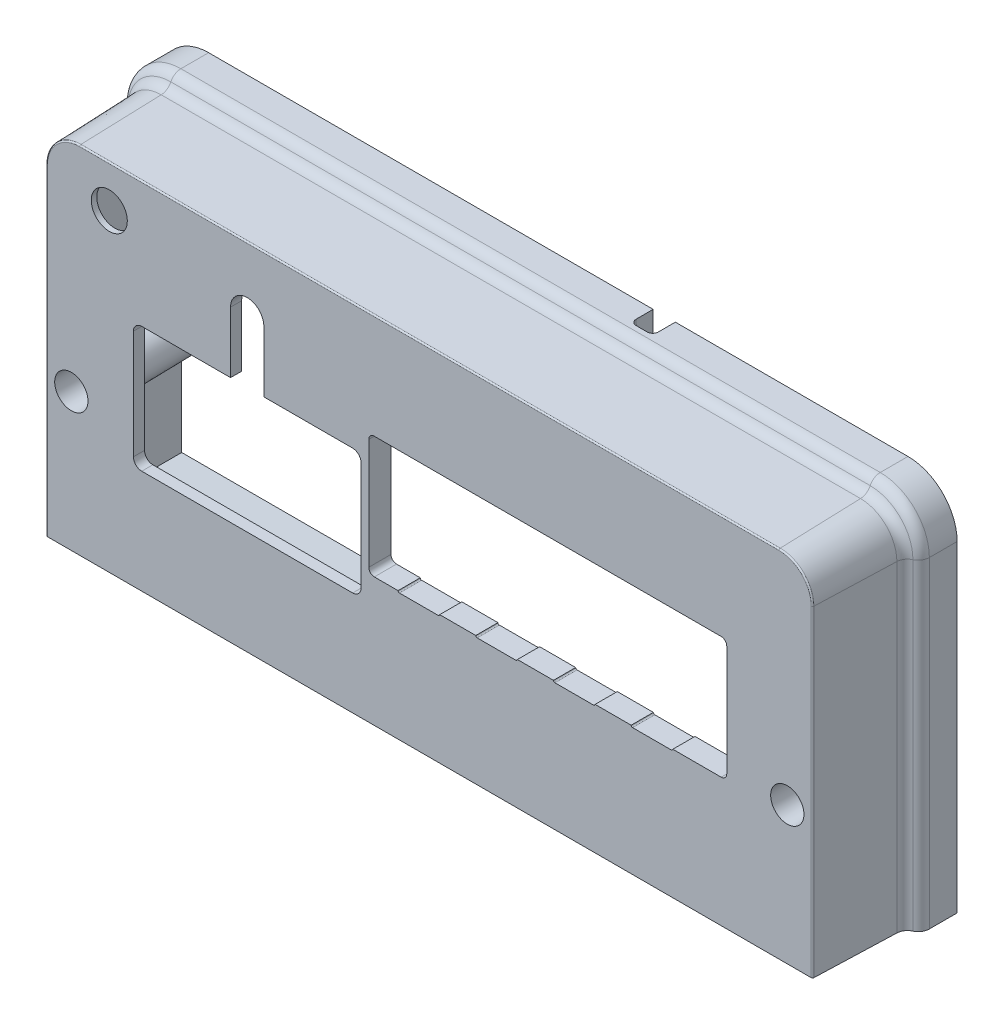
SolidWorks part; units mm, degrees
ref_plane "Front Plane" through (0, 0, 0) normal (0, 0, 1) x (1, 0, 0)
ref_plane "Top Plane" through (0, 0, 0) normal (0, 1, 0) x (1, 0, 0)
ref_plane "Right Plane" through (0, 0, 0) normal (1, 0, 0) x (0, 0, -1)
sketch "Sketch1" plane through (0, 0, 0) normal (0, 0, 1) x (1, 0, 0)
  line L0 (70.3419, -32.2819) -> (70.3419, 25.677)
  line L1 (63.4919, 32.527) -> (-62.5081, 32.527)
  line L2 (-69.3581, 25.677) -> (-69.3581, -32.2819)
  line L3 (69.8419, -32.773) -> (69.8419, 25.677) construction
  line L4 (63.4919, 32.027) -> (-62.5081, 32.027) construction
  line L5 (-68.8581, 25.677) -> (-68.8581, -32.773) construction
  line L6 (69.8419, -32.773) -> (-68.8581, -32.773) construction
  line L7 (70.3419, -32.2819) -> (-69.3581, -32.2819)
  arc A0 (69.8419, 25.677) -> (63.4919, 32.027) centre (63.4919, 25.677) ccw construction
  arc A1 (-62.5081, 32.027) -> (-68.8581, 25.677) centre (-62.5081, 25.677) ccw construction
  arc A2 (70.3419, 25.677) -> (63.4919, 32.527) centre (63.4919, 25.677) ccw
  arc A3 (-62.5081, 32.527) -> (-69.3581, 25.677) centre (-62.5081, 25.677) ccw
extrude "Extrude1" add sketch "Sketch1" along normal blind 23.24 draft 2
shell "Shell2" thickness 2
sketch "Sketch3" plane through (0, 0, 23.24) normal (0, 0, 1) x (1, 0, 0)
  line L14 (-51.3198, -13.063) -> (-42.3198, -13.063) construction
  line L15 (-42.3198, -13.063) -> (-32.3198, -13.063) construction
  line L16 (-32.3198, -13.063) -> (-22.3198, -13.063) construction
  line L17 (-22.3198, -13.063) -> (-13.3198, -13.063) construction
  line L18 (-12.3198, -0.863) -> (-12.3198, 7.537) construction
  line L19 (-52.3198, 7.537) -> (-52.3198, -0.863) construction
  line L20 (-42.3198, 8.537) -> (-51.3198, 8.537) construction
  line L21 (-32.3198, 8.537) -> (-42.3198, 8.537) construction
  line L22 (-22.3198, 8.537) -> (-32.3198, 8.537) construction
  line L23 (-13.3198, 8.537) -> (-22.3198, 8.537) construction
  line L24 (53.5802, 11.847) -> (53.5802, -8.103) construction
  line L25 (53.0802, -8.603) -> (-9.4198, -8.603) construction
  line L26 (-9.9198, -8.103) -> (-9.9198, 11.847) construction
  line L27 (-9.4198, 12.347) -> (53.0802, 12.347) construction
  line L28 (-12.3198, -0.863) -> (-12.3198, -12.063) construction
  line L29 (-52.3198, -12.063) -> (-52.3198, -0.863) construction
  line L30 (-51.3198, -13.563) -> (-42.3198, -13.563)
  line L31 (-42.3198, -13.563) -> (-32.3198, -13.563)
  line L32 (-32.3198, -13.563) -> (-22.3198, -13.563)
  line L33 (-22.3198, -13.563) -> (-13.3198, -13.563)
  line L34 (-11.8198, -0.863) -> (-11.8198, -12.063)
  line L35 (-11.8198, -0.863) -> (-11.8198, 7.537)
  line L36 (-13.3198, 9.037) -> (-22.3198, 9.037)
  line L37 (-22.3198, 9.037) -> (-32.3198, 9.037)
  line L38 (-32.3198, 9.037) -> (-42.3198, 9.037)
  line L39 (-42.3198, 9.037) -> (-51.3198, 9.037)
  line L40 (-52.8198, 7.537) -> (-52.8198, -0.863)
  line L41 (-52.8198, -12.063) -> (-52.8198, -0.863)
  line L42 (54.0802, 11.847) -> (54.0802, -8.103)
  line L43 (53.0802, -9.103) -> (-9.4198, -9.103)
  line L44 (-10.4198, -8.103) -> (-10.4198, 11.847)
  line L45 (-9.4198, 12.847) -> (53.0802, 12.847)
  arc A4 (53.5802, 11.847) -> (53.0802, 12.347) centre (53.0802, 11.847) ccw construction
  arc A5 (53.0802, -8.603) -> (53.5802, -8.103) centre (53.0802, -8.103) ccw construction
  arc A6 (-9.9198, -8.103) -> (-9.4198, -8.603) centre (-9.4198, -8.103) ccw construction
  arc A7 (-9.4198, 12.347) -> (-9.9198, 11.847) centre (-9.4198, 11.847) ccw construction
  arc A8 (-13.3198, -13.063) -> (-12.3198, -12.063) centre (-13.3198, -12.063) ccw construction
  arc A9 (-52.3198, -12.063) -> (-51.3198, -13.063) centre (-51.3198, -12.063) ccw construction
  arc A10 (-51.3198, 8.537) -> (-52.3198, 7.537) centre (-51.3198, 7.537) ccw construction
  arc A11 (-12.3198, 7.537) -> (-13.3198, 8.537) centre (-13.3198, 7.537) ccw construction
  arc A12 (-13.3198, -13.563) -> (-11.8198, -12.063) centre (-13.3198, -12.063) ccw
  arc A13 (-11.8198, 7.537) -> (-13.3198, 9.037) centre (-13.3198, 7.537) ccw
  arc A14 (-51.3198, 9.037) -> (-52.8198, 7.537) centre (-51.3198, 7.537) ccw
  arc A15 (-52.8198, -12.063) -> (-51.3198, -13.563) centre (-51.3198, -12.063) ccw
  arc A16 (53.0802, -9.103) -> (54.0802, -8.103) centre (53.0802, -8.103) ccw
  arc A17 (-10.4198, -8.103) -> (-9.4198, -9.103) centre (-9.4198, -8.103) ccw
  arc A18 (-9.4198, 12.847) -> (-10.4198, 11.847) centre (-9.4198, 11.847) ccw
  arc A19 (54.0802, 11.847) -> (53.0802, 12.847) centre (53.0802, 11.847) ccw
  dimension "D1" = 1
  dimension "D2" = 0.5
extrude "Cut-Extrude2" cut sketch "Sketch3" against normal blind 2
sketch "Sketch4" plane through (0, 0, 23.24) normal (0, 0, 1) x (1, 0, 0)
  line L4 (-62.0198, 20.327) -> (-62.0198, 28.027) construction
  line L5 (-61.0198, 29.027) -> (-53.3198, 29.027) construction
  line L6 (-52.3198, 28.027) -> (-52.3198, 20.327) construction
  line L7 (-53.3198, 19.327) -> (-61.0198, 19.327) construction
  line L8 (-62.5198, 20.327) -> (-62.5198, 28.027)
  line L9 (-61.0198, 29.527) -> (-53.3198, 29.527)
  line L10 (-51.8198, 28.027) -> (-51.8198, 20.327)
  line L11 (-53.3198, 18.827) -> (-61.0198, 18.827)
  arc A0 (-62.0198, 20.327) -> (-61.0198, 19.327) centre (-61.0198, 20.327) ccw construction
  arc A1 (-62.0198, 28.027) -> (-61.0198, 29.027) centre (-61.0198, 28.027) cw construction
  arc A2 (-52.3198, 28.027) -> (-53.3198, 29.027) centre (-53.3198, 28.027) ccw construction
  arc A3 (-53.3198, 19.327) -> (-52.3198, 20.327) centre (-53.3198, 20.327) ccw construction
  arc A4 (-62.5198, 28.027) -> (-61.0198, 29.527) centre (-61.0198, 28.027) cw
  arc A5 (-51.8198, 28.027) -> (-53.3198, 29.527) centre (-53.3198, 28.027) ccw
  arc A6 (-53.3198, 18.827) -> (-51.8198, 20.327) centre (-53.3198, 20.327) ccw
  arc A7 (-62.5198, 20.327) -> (-61.0198, 18.827) centre (-61.0198, 20.327) ccw
extrude "Cut-Extrude3" cut sketch "Sketch4" against normal blind 2
sketch "Sketch5" plane through (0, 0, 23.24) normal (0, 0, 1) x (1, 0, 0)
  line L4 (-51.8198, 20.327) -> (-51.8198, 28.027)
  line L5 (-53.3198, 29.527) -> (-61.0198, 29.527)
  line L6 (-62.5198, 28.027) -> (-62.5198, 20.327)
  line L7 (-61.0198, 18.827) -> (-53.3198, 18.827)
  arc A4 (-53.3198, 18.827) -> (-51.8198, 20.327) centre (-53.3198, 20.327) ccw
  arc A5 (-51.8198, 28.027) -> (-53.3198, 29.527) centre (-53.3198, 28.027) ccw
  arc A6 (-61.0198, 29.527) -> (-62.5198, 28.027) centre (-61.0198, 28.027) ccw
  arc A7 (-62.5198, 20.327) -> (-61.0198, 18.827) centre (-61.0198, 20.327) ccw
  circle A9 centre (-57.1698, 24.177) radius 3.25
extrude "Extrude2" add sketch "Sketch5" against normal blind 1
sketch "Sketch6" plane through (0, 0, 23.24) normal (0, 0, 1) x (1, 0, 0)
  line L0 (-13.3198, 9.037) -> (-51.3198, 9.037) construction
  line L1 (-29.3198, 9.037) -> (-35.3198, 9.037)
  line L2 (-29.3198, 9.037) -> (-29.3198, 20.037)
  line L4 (-35.3198, 9.037) -> (-35.3198, 20.037)
  arc A0 (-29.3198, 20.037) -> (-35.3198, 20.037) centre (-32.3198, 20.037) ccw
  point P10 (-35.3198, 21.037)
  point P13 (-29.3198, 21.037)
extrude "Cut-Extrude4" cut sketch "Sketch6" against normal blind 2
sketch "Sketch10" plane through (0, 0, 23.24) normal (0, 0, 1) x (1, 0, 0)
  line L0 (-69.3581, -32.2819) -> (70.3419, -32.2819) construction
  line L1 (-72.1639, -31.4703) -> (73.5887, -31.4703)
  line L2 (-72.1639, -31.4703) -> (-72.1639, -32.2819)
  line L3 (-72.1639, -32.2819) -> (73.5887, -32.2819)
  line L4 (73.5887, -31.4703) -> (73.5887, -32.2819)
  line L5 (-68.5465, -31.4703) -> (69.5304, -31.4703) construction
extrude "Extrude3" add sketch "Sketch10" against normal through all
sketch "Sketch11" plane through (0, -31.4703, 0) normal (0, 1, 0) x (-1, 0, 0)
  line L4 (68.5465, 23.24) -> (69.3581, 0)
  line L5 (69.3581, 0) -> (72.1639, 0)
  line L6 (72.1639, 0) -> (72.1639, 23.24)
  line L7 (72.1639, 23.24) -> (68.5465, 23.24)
  line L8 (68.5465, 23.24) -> (69.3581, 0)
  line L9 (69.3581, 0) -> (72.1639, 0)
  line L10 (72.1639, 0) -> (72.1639, 23.24)
  line L11 (72.1639, 23.24) -> (68.5465, 23.24)
  line L16 (-70.3419, 0) -> (-69.5304, 23.24)
  line L17 (-69.5304, 23.24) -> (-73.5887, 23.24)
  line L18 (-73.5887, 23.24) -> (-73.5887, 0)
  line L19 (-73.5887, 0) -> (-70.3419, 0)
  line L20 (-70.3419, 0) -> (-69.5304, 23.24)
  line L21 (-69.5304, 23.24) -> (-73.5887, 23.24)
  line L22 (-73.5887, 23.24) -> (-73.5887, 0)
  line L23 (-73.5887, 0) -> (-70.3419, 0)
  dimension "D1" = 0
  dimension "D2" = 0
extrude "Cut-Extrude5" cut sketch "Sketch11" against normal up to next
sketch "Sketch12" plane through (0, 0, 23.24) normal (0, 0, 1) x (1, 0, 0)
  line L0 (-68.5465, 25.677) -> (-68.5465, -32.2819) construction
  line L1 (-64.0047, -11.473) -> (-68.5465, -11.473)
  line L2 (64.9886, -3.473) -> (69.5304, -3.473)
  line L3 (-64.0047, -3.473) -> (-68.5465, -3.473)
  line L4 (-68.5465, -11.473) -> (-68.5465, -3.473)
  line L6 (64.9886, -11.473) -> (69.5304, -11.473)
  line L9 (69.5304, -11.473) -> (69.5304, -3.473)
  arc A2 (64.9886, -3.473) -> (64.9886, -11.473) centre (64.9886, -7.473) ccw
  arc A3 (-64.0047, -11.473) -> (-64.0047, -3.473) centre (-64.0047, -7.473) ccw
extrude "Extrude5" add sketch "Sketch12" against normal through all draft 1
sketch "Sketch14" plane through (0, 0, 23.24) normal (0, 0, 1) x (1, 0, 0)
  circle A0 centre (-64.0047, -7.473) radius 3
  circle A1 centre (64.9886, -7.473) radius 3
extrude "Cut-Extrude6" cut sketch "Sketch14" against normal blind 15 draft 1
sketch "Sketch15" [suppressed] plane through (0, 0, 8.24) normal (0, 0, 1) x (1, 0, 0)
  circle A1 centre (-64.0047, -7.473) radius 1.75
  circle A3 centre (64.9886, -7.473) radius 1.75
extrude "Cut-Extrude7" [suppressed] cut sketch "Sketch15" against normal up to next draft 1
fillet "Fillet6" radius 2 1 edges at (-66.986, -3.6933, 10.62)
fillet "Fillet7" radius 2 1 edges at (-66.986, -11.2527, 10.62)
fillet "Fillet8" radius 2 1 edges at (67.9699, -11.2527, 10.62)
fillet "Fillet9" radius 2 1 edges at (67.9699, -3.6933, 10.62)
fillet "Fillet11" radius 0.25 5 edges at (-66.7779, 29.9468, 23.24) (-68.5465, -3.3024, 23.24) (69.5304, -3.3024, 23.24) (67.7618, 29.9468, 23.24) (0.4919, 31.7155, 23.24)
sketch "Sketch17" plane through (0, 0, 21.24) normal (0, 0, -1) x (-1, 0, 0)
  line L0 (11.8198, -11.103) -> (11.8198, 14.847)
  line L1 (11.8198, -12.063) -> (11.8198, 7.537) construction
  line L2 (9.4198, -11.103) -> (7.9316, -11.103)
  line L3 (11.8198, 14.847) -> (9.4198, 14.847)
  line L4 (11.8198, -11.103) -> (9.4198, -11.103)
  line L11 (-54.0802, -8.103) -> (-54.0802, 11.847)
  line L12 (10.4198, 11.847) -> (10.4198, -8.103)
  line L20 (9.4198, -9.103) -> (-53.0802, -9.103)
  line L21 (-53.0802, 12.847) -> (9.4198, 12.847)
  line L32 (-56.0802, -8.103) -> (-56.0802, 11.847)
  line L33 (-53.0802, 14.847) -> (9.4198, 14.847)
  line L35 (7.9316, -11.103) -> (-53.0802, -11.103)
  arc A18 (9.4198, -9.103) -> (10.4198, -8.103) centre (9.4198, -8.103) ccw
  arc A19 (10.4198, 11.847) -> (9.4198, 12.847) centre (9.4198, 11.847) ccw
  arc A20 (-53.0802, 12.847) -> (-54.0802, 11.847) centre (-53.0802, 11.847) ccw
  arc A21 (-54.0802, -8.103) -> (-53.0802, -9.103) centre (-53.0802, -8.103) ccw
  arc A22 (-53.0802, 14.847) -> (-56.0802, 11.847) centre (-53.0802, 11.847) ccw
  arc A25 (-56.0802, -8.103) -> (-53.0802, -11.103) centre (-53.0802, -8.103) ccw
  dimension "D6" = 2
extrude "Extrude7" add sketch "Sketch17" along normal blind 2
sketch "Sketch18" plane through (0, 32.4874, 1.1345) normal (0, 0.9994, 0.0349) x (-1, 0, 0)
  line L4 (-21.5802, -1.1352) -> (-17.5802, -1.1352)
  line L5 (-17.5802, 1.8648) -> (-17.5802, -1.1352)
  line L6 (-20.5802, 2.8648) -> (-18.5802, 2.8648)
  line L7 (-21.5802, 1.8648) -> (-21.5802, -1.1352)
  line L8 (-63.4919, -1.1352) -> (62.5081, -1.1352) construction
  arc A0 (-20.5802, 2.8648) -> (-21.5802, 1.8648) centre (-20.5802, 1.8648) ccw
  arc A1 (-17.5802, 1.8648) -> (-18.5802, 2.8648) centre (-18.5802, 1.8648) ccw
  point P8 (-21.5802, 2.8648)
  dimension "D2" = 1
  dimension "D1" = 4
extrude "Cut-Extrude10" cut sketch "Sketch18" against normal up to next
sketch "Sketch21" plane through (0, 0, 23.24) normal (0, 0, 1) x (1, 0, 0)
  line L0 (-9.4198, -9.103) -> (53.0802, -9.103) construction
  line L1 (-5.1398, -9.103) -> (2.3602, -9.103)
  line L2 (-5.1398, -9.103) -> (-5.1398, -9.353)
  line L3 (-5.1398, -9.353) -> (2.3602, -9.353)
  line L4 (2.3602, -9.103) -> (2.3602, -9.353)
  line L5 (-1.3898, -9.353) -> (-1.3898, -9.103) construction
  line L6 (8.8602, -9.103) -> (16.3602, -9.103)
  line L7 (8.8602, -9.103) -> (8.8602, -9.353)
  line L8 (8.8602, -9.353) -> (16.3602, -9.353)
  line L9 (16.3602, -9.103) -> (16.3602, -9.353)
  line L10 (22.8602, -9.103) -> (30.3602, -9.103)
  line L11 (22.8602, -9.103) -> (22.8602, -9.353)
  line L12 (22.8602, -9.353) -> (30.3602, -9.353)
  line L13 (30.3602, -9.103) -> (30.3602, -9.353)
  line L14 (36.8602, -9.103) -> (44.3602, -9.103)
  line L15 (36.8602, -9.103) -> (36.8602, -9.353)
  line L16 (36.8602, -9.353) -> (44.3602, -9.353)
  line L17 (44.3602, -9.103) -> (44.3602, -9.353)
  line L18 (12.6102, -9.353) -> (12.6102, -9.103) construction
  line L19 (26.6102, -9.353) -> (26.6102, -9.103) construction
  line L20 (40.6102, -9.353) -> (40.6102, -9.103) construction
  line L21 (-10.4198, 11.847) -> (-10.4198, -8.103) construction
  dimension "D1" = 14
  dimension "D2" = 14
  dimension "D3" = 14
  dimension "D4" = 7.5
  dimension "D5" = 9.03
  dimension "D6" = 0.25
extrude "Cut-Extrude11" cut sketch "Sketch21" against normal up to next
fillet "Fillet22" radius 0.25 3 edges at (44.3602, -9.228, 19.24) (44.3602, -9.353, 21.24) (44.3602, -9.228, 23.24)
fillet "Fillet23" radius 0.25 3 edges at (30.3602, -9.228, 19.24) (30.3602, -9.353, 21.24) (30.3602, -9.228, 23.24)
fillet "Fillet24" radius 0.25 3 edges at (16.3602, -9.228, 19.24) (16.3602, -9.353, 21.24) (16.3602, -9.228, 23.24)
fillet "Fillet25" radius 0.25 3 edges at (2.3602, -9.228, 19.24) (2.3602, -9.353, 21.24) (2.3602, -9.228, 23.24)
fillet "Fillet26" radius 0.25 3 edges at (-5.1398, -9.228, 19.24) (-5.1398, -9.353, 21.24) (-5.1398, -9.228, 23.24)
fillet "Fillet27" radius 0.25 3 edges at (8.8602, -9.228, 19.24) (8.8602, -9.353, 21.24) (8.8602, -9.228, 23.24)
fillet "Fillet28" radius 0.25 3 edges at (22.8602, -9.228, 19.24) (22.8602, -9.353, 21.24) (22.8602, -9.228, 23.24)
fillet "Fillet29" radius 0.25 3 edges at (36.8602, -9.228, 19.24) (36.8602, -9.353, 21.24) (36.8602, -9.228, 23.24)
fillet "Fillet31" radius 2 1 edges at (67.9699, -29.9098, 10.62)
sketch "Sketch37" [suppressed] plane through (0, 0, 23.24) normal (0, 0, 1) x (1, 0, 0)
  line L4 (69.2889, -32.2819) -> (69.2889, 25.677)
  line L5 (69.2889, -32.2819) -> (69.2889, 25.677)
  line L6 (63.4919, 31.474) -> (-62.5081, 31.474)
  line L7 (-68.3051, -32.2819) -> (69.2889, -32.2819)
  line L8 (63.4919, 31.474) -> (-62.5081, 31.474)
  line L9 (-68.3051, 25.677) -> (-68.3051, -32.2819)
  line L10 (-68.3051, 25.677) -> (-68.3051, -32.2819)
  line L11 (-68.3051, -32.2819) -> (69.2889, -32.2819)
  arc A2 (69.2889, 25.677) -> (63.4919, 31.474) centre (63.4919, 25.677) ccw
  arc A3 (69.2889, 25.677) -> (63.4919, 31.474) centre (63.4919, 25.677) ccw
  arc A4 (-62.5081, 31.474) -> (-68.3051, 25.677) centre (-62.5081, 25.677) ccw
  arc A5 (-62.5081, 31.474) -> (-68.3051, 25.677) centre (-62.5081, 25.677) ccw
  dimension "D1" = 0
sketch "Sketch38" plane through (0, 0, 23.24) normal (0, 0, 1) x (1, 0, 0)
  line L0 (-68.5465, -32.2819) -> (-68.5465, 25.677) construction
sketch "Sketch39" plane through (0, 0, 23.24) normal (0, 0, 1) x (1, 0, 0)
  line L1 (54.3731, 12.5541) -> (-10.1269, 12.5541) construction
  line L2 (54.3731, 12.5541) -> (54.3731, -15.7542) construction
  line L3 (54.3731, -15.7542) -> (-10.1269, -15.7542) construction
  line L4 (-10.1269, 12.5541) -> (-10.1269, -15.7542) construction
  arc A0 (-9.4198, 12.847) -> (-10.4198, 11.847) centre (-9.4198, 11.847) ccw construction
sketch "Sketch41" plane through (0, 0, 0) normal (0, 0, -1) x (-1, 0, 0)
  line L0 (69.3581, 25.677) -> (69.3581, -32.2819) construction
  line L1 (-17.5802, 32.527) -> (62.5081, 32.527) construction
  line L2 (-63.4919, 32.527) -> (-21.5802, 32.527) construction
  line L3 (-70.3419, -32.2819) -> (-70.3419, 25.677) construction
  line L4 (69.3581, 25.677) -> (69.3581, -32.2819) construction
  line L5 (-17.5802, 32.527) -> (62.5081, 32.527) construction
  line L6 (-63.4919, 32.527) -> (-21.5802, 32.527) construction
  line L7 (-70.3419, -32.2819) -> (-70.3419, 25.677) construction
  line L8 (-17.5802, 32.527) -> (-21.5802, 32.527) construction
  line L9 (-68.3419, -32.2819) -> (-68.3419, 25.677)
  line L10 (-63.4919, 30.527) -> (-21.5802, 30.527)
  line L11 (-17.5802, 30.527) -> (-21.5802, 30.527)
  line L12 (-17.5802, 30.527) -> (62.5081, 30.527)
  line L13 (67.3581, 25.677) -> (67.3581, -32.2819)
  line L14 (-72.3419, -32.2819) -> (-72.3419, 25.677)
  line L15 (-63.4919, 34.527) -> (-21.5802, 34.527)
  line L16 (-17.5802, 34.527) -> (-21.5802, 34.527)
  line L17 (-17.5802, 34.527) -> (62.5081, 34.527)
  line L18 (71.3581, 25.677) -> (71.3581, -32.2819)
  line L19 (-68.3419, -32.2819) -> (-72.3419, -32.2819)
  line L20 (71.3581, -32.2819) -> (67.3581, -32.2819)
  arc A0 (69.3581, 25.677) -> (62.5081, 32.527) centre (62.5081, 25.677) ccw construction
  arc A1 (-63.4919, 32.527) -> (-70.3419, 25.677) centre (-63.4919, 25.677) ccw construction
  arc A2 (69.3581, 25.677) -> (62.5081, 32.527) centre (62.5081, 25.677) ccw construction
  arc A3 (-63.4919, 32.527) -> (-70.3419, 25.677) centre (-63.4919, 25.677) ccw construction
  arc A4 (-63.4919, 30.527) -> (-68.3419, 25.677) centre (-63.4919, 25.677) ccw
  arc A5 (67.3581, 25.677) -> (62.5081, 30.527) centre (62.5081, 25.677) ccw
  arc A6 (-63.4919, 34.527) -> (-72.3419, 25.677) centre (-63.4919, 25.677) ccw
  arc A7 (71.3581, 25.677) -> (62.5081, 34.527) centre (62.5081, 25.677) ccw
  dimension "D1" = 2
  dimension "D2" = 2
extrude "Extrude12" add sketch "Sketch41" against normal blind 7
sketch "top_sketch1" plane through (0, 0, 0) normal (0, 1, 0) x (1, 0, 0)
  line L8 (72.3419, 0) -> (-71.3581, 0)
  line L9 (72.3419, -7) -> (72.3419, 0)
  line L10 (70.0975, -7) -> (72.3419, -7)
  line L11 (69.5388, -22.9987) -> (70.0975, -7)
  line L12 (-68.3051, -23.24) -> (69.2889, -23.24)
  line L13 (-69.1136, -7) -> (-68.5549, -22.9987)
  line L14 (-71.3581, -7) -> (-69.1136, -7)
  line L15 (-71.3581, 0) -> (-71.3581, -7)
  line L16 (72.3419, 0) -> (-71.3581, 0) construction
  line L17 (72.3419, -7) -> (72.3419, 0) construction
  line L18 (70.0975, -7) -> (72.3419, -7) construction
  line L19 (69.5388, -22.9987) -> (70.0975, -7) construction
  line L20 (-68.3051, -23.24) -> (69.2889, -23.24) construction
  line L21 (-69.1136, -7) -> (-68.5549, -22.9987) construction
  line L22 (-71.3581, -7) -> (-69.1136, -7) construction
  line L23 (-71.3581, 0) -> (-71.3581, -7) construction
  arc A2 (69.2889, -23.24) -> (69.5388, -22.9987) centre (69.2889, -22.99) ccw
  arc A3 (-68.5549, -22.9987) -> (-68.3051, -23.24) centre (-68.3051, -22.99) ccw
  arc A4 (69.2889, -23.24) -> (69.5388, -22.9987) centre (69.2889, -22.99) ccw construction
  arc A5 (-68.5549, -22.9987) -> (-68.3051, -23.24) centre (-68.3051, -22.99) ccw construction
  point P6 (-69.3581, 0)
  point P8 (70.3419, 0)
  dimension "D2" = 143.7
  dimension "D3" = 7
  dimension "D4" = 139.7
  dimension "D5" = 2
  dimension "D6" = 23.24
  dimension "D7" = 92
  dimension "D1" = 0
fillet "Fillet39" radius 2 5 edges at (72.3419, -3.3024, 7) (69.7498, 31.9349, 7) (0.4919, 34.527, 7) (-68.766, 31.9349, 7) (-71.3581, -3.3024, 7)
fillet "Fillet40" radius 2 12 edges at (-69.2358, -32.2819, 7) (-69.1136, -3.3024, 7) (-67.1789, 30.3479, 7) (0.4919, 32.2826, 7) (68.1628, 30.3479, 7) (70.0975, -3.3024, 7) (70.2197, -32.2819, 7) (70.3419, -3.3024, 7) (68.3356, 30.5207, 7) (0.4919, 32.527, 7) (-67.3518, 30.5207, 7) (-69.3581, -3.3024, 7)
sketch "Sketch45" plane through (0, 30.4886, 1.0647) normal (0, -0.9994, -0.0349) x (1, 0, 0)
  line L1 (17.5802, -1.0653) -> (17.5802, 1.8648) construction
  line L2 (18.5802, 2.8648) -> (20.5802, 2.8648) construction
  line L3 (21.5802, 1.8648) -> (21.5802, -1.0653) construction
  line L5 (17.5802, -1.0653) -> (17.5802, 1.8648)
  line L6 (18.5802, 2.8648) -> (20.5802, 2.8648)
  line L7 (21.5802, 1.8648) -> (21.5802, -1.0653)
  line L10 (21.5802, -1.0653) -> (21.5802, -2.0875)
  line L11 (21.5802, -2.0875) -> (17.5802, -2.0875)
  line L12 (17.5802, -1.0653) -> (17.5802, -2.0875)
  arc A0 (18.5802, 2.8648) -> (17.5802, 1.8648) centre (18.5802, 1.8648) ccw construction
  arc A1 (21.5802, 1.8648) -> (20.5802, 2.8648) centre (20.5802, 1.8648) ccw construction
  arc A2 (18.5802, 2.8648) -> (17.5802, 1.8648) centre (18.5802, 1.8648) ccw
  arc A3 (21.5802, 1.8648) -> (20.5802, 2.8648) centre (20.5802, 1.8648) ccw
extrude "Cut-Extrude19" cut sketch "Sketch45" against normal blind 10
sketch "Sketch46" [suppressed] plane through (0, -32.2819, 0) normal (0, -1, 0) x (1, 0, 0)
  line L3 (-9.0581, 0) -> (-9.0581, 13.74)
  line L4 (-13.4581, 13.74) -> (-13.4581, 0)
  line L5 (-9.0581, 13.74) -> (-13.4581, 13.74)
  line L6 (-13.4581, 0) -> (-9.0581, 0)
extrude "Cut-Extrude20" [suppressed] cut sketch "Sketch46" against normal up to next
sketch "Sketch47" [suppressed] plane through (0, 0, 0) normal (0, 0, -1) x (-1, 0, 0)
  line L1 (13.4581, -30.2806) -> (15.4581, -30.2806)
  line L2 (13.4581, -30.2806) -> (13.4581, -27.0226)
  line L3 (13.4581, -27.0226) -> (15.4581, -27.0226)
  line L4 (15.4581, -30.2806) -> (15.4581, -27.0226)
  line L5 (9.0581, -30.2806) -> (7.0581, -30.2806)
  line L6 (9.0581, -30.2806) -> (9.0581, -27.0226)
  line L7 (9.0581, -27.0226) -> (7.0581, -27.0226)
  line L8 (7.0581, -30.2806) -> (7.0581, -27.0226)
  dimension "D1" = 2
  dimension "D2" = 2
  dimension "D3" = 3.258
  dimension "D4" = 3.258
extrude "Extrude13" [suppressed] add sketch "Sketch47" against normal up to surface (21.24 mm away)
sketch "Sketch48" [suppressed] plane through (0, 0, 21.24) normal (0, 0, -1) x (-1, 0, 0)
  line L1 (9.0581, -27.0226) -> (7.0581, -27.0226)
  line L2 (9.0581, -27.0226) -> (9.0581, -23.0226)
  line L3 (9.0581, -23.0226) -> (7.0581, -23.0226)
  line L4 (7.0581, -27.0226) -> (7.0581, -23.0226)
  line L5 (13.4581, -27.0226) -> (15.4581, -27.0226)
  line L6 (13.4581, -27.0226) -> (13.4581, -21.0226)
  line L7 (13.4581, -21.0226) -> (15.4581, -21.0226)
  line L8 (15.4581, -27.0226) -> (15.4581, -21.0226)
  dimension "D1" = 4
  dimension "D2" = 6
extrude "Extrude14" [suppressed] add sketch "Sketch48" along normal up to surface (16.68 mm away)
sketch "Sketch50" [suppressed] plane through (0, 0, 4.56) normal (0, 0, -1) x (-1, 0, 0)
  line L0 (13.9698, -21.023) -> (13.4581, -21.023)
  line L3 (13.4581, -21.023) -> (13.4581, -20.923)
  line L4 (14.8698, -21.923) -> (14.8698, -23.2388)
  line L5 (13.4581, -20.923) -> (15.4581, -20.923)
  line L7 (15.3713, -25.12) -> (15.4581, -25.2711)
  line L10 (15.4581, -25.2711) -> (15.4581, -20.923)
  arc A0 (14.8698, -23.2388) -> (15.3713, -25.12) centre (18.649, -23.2388) ccw
  arc A1 (14.8698, -21.923) -> (13.9698, -21.023) centre (13.9698, -21.923) ccw
extrude "Cut-Extrude21" [suppressed] cut sketch "Sketch50" against normal blind 3.1
sketch "Sketch52" [suppressed] plane through (0, 0, 21.24) normal (0, 0, -1) x (-1, 0, 0)
  line L0 (13.4581, -21.0226) -> (13.4581, -29.5389) construction
  line L1 (15.4581, -21.0226) -> (13.4581, -21.0226)
  line L2 (15.4581, -21.0226) -> (15.4581, -13.563)
  line L3 (15.4581, -13.563) -> (13.4581, -13.563)
  line L4 (13.4581, -21.0226) -> (13.4581, -13.563)
  line L5 (9.0581, -23.0226) -> (7.0581, -23.0226)
  line L6 (9.0581, -23.0226) -> (9.0581, -11.103)
  line L7 (9.0581, -11.103) -> (7.0581, -11.103)
  line L8 (7.0581, -23.0226) -> (7.0581, -11.103)
  line L9 (15.4581, -29.5389) -> (15.4581, -21.0226) construction
  line L10 (9.0581, -29.5389) -> (9.0581, -23.0226) construction
  line L11 (7.0581, -23.0226) -> (7.0581, -29.5389) construction
  line L12 (-53.0802, -11.103) -> (11.8198, -11.103) construction
extrude "Extrude15" [suppressed] add sketch "Sketch52" along normal blind 3
sketch "Sketch53" [suppressed] plane through (0, 0, 18.24) normal (0, 0, -1) x (-1, 0, 0)
  line L1 (9.0581, -23.0226) -> (7.0581, -23.0226)
  line L2 (9.0581, -23.0226) -> (9.0581, -11.103)
  line L3 (9.0581, -11.103) -> (7.0581, -11.103)
  line L4 (7.0581, -23.0226) -> (7.0581, -11.103)
extrude "Extrude16" [suppressed] add sketch "Sketch53" along normal blind 2
fillet "Fillet41" [suppressed] radius 2
fillet "Fillet42" [suppressed] radius 2
fillet "Fillet43" [suppressed] radius 2
fillet "Fillet44" [suppressed] radius 2
fillet "Fillet45" [suppressed] radius 2
fillet "Fillet46" [suppressed] radius 2
sketch "Sketch54" [suppressed] plane through (0, 0, 19.24) normal (0, 0, -1) x (-1, 0, 0)
  line L0 (5.1398, -9.103) -> (9.4198, -9.103) construction
  line L1 (9.0581, -11.103) -> (7.0581, -11.103)
  line L2 (9.0581, -11.103) -> (9.0581, -9.103)
  line L3 (9.0581, -9.103) -> (7.0581, -9.103)
  line L4 (7.0581, -11.103) -> (7.0581, -9.103)
extrude "Extrude17" [suppressed] add sketch "Sketch54" along normal up to surface (3 mm away)
sketch "front_sketch" plane through (0, 0, 0) normal (0, 0, 1) x (1, 0, 0)
  line L0 (-68.3051, -32.2819) -> (69.2889, -32.2819) construction
  line L1 (-64.0047, -7.473) -> (64.9886, -7.473) construction
  line L2 (0.4919, -32.2819) -> (0.4919, -7.473) construction
  line L18 (17.5802, 34.527) -> (-62.5081, 34.527)
  line L19 (17.5802, 30.5258) -> (17.5802, 34.527)
  line L20 (-62.5081, 30.5258) -> (17.5802, 30.5258)
  line L21 (-67.3569, -1.8796) -> (-67.3569, 25.677)
  line L22 (-64.0047, -3.8786) -> (-65.3569, -3.8786)
  line L23 (-65.3569, -11.0673) -> (-64.0047, -11.0673)
  line L24 (-67.3569, -30.2806) -> (-67.3569, -13.0664)
  line L25 (66.3419, -30.2806) -> (-67.3569, -30.2806)
  line L26 (68.3407, -13.0664) -> (68.3407, -28.2819)
  line L27 (64.9886, -11.0673) -> (66.3407, -11.0673)
  line L28 (66.3407, -3.8786) -> (64.9886, -3.8786)
  line L29 (68.3407, 25.677) -> (68.3407, -1.8796)
  line L30 (21.5802, 30.5258) -> (63.4919, 30.5258)
  line L31 (21.5802, 34.527) -> (21.5802, 30.5258)
  line L32 (63.4919, 34.527) -> (21.5802, 34.527)
  line L33 (72.3419, -32.2819) -> (72.3419, 25.677)
  line L34 (-71.3581, -32.2819) -> (72.3419, -32.2819)
  line L35 (-71.3581, 25.677) -> (-71.3581, -32.2819)
  line L36 (17.5802, 34.527) -> (-62.5081, 34.527) construction
  line L37 (17.5802, 30.5258) -> (17.5802, 34.527) construction
  line L38 (-62.5081, 30.5258) -> (17.5802, 30.5258) construction
  line L39 (-67.3569, -1.8796) -> (-67.3569, 25.677) construction
  line L40 (-64.0047, -3.8786) -> (-65.3569, -3.8786) construction
  line L41 (-65.3569, -11.0673) -> (-64.0047, -11.0673) construction
  line L42 (-67.3569, -30.2806) -> (-67.3569, -13.0664) construction
  line L43 (66.3419, -30.2806) -> (-67.3569, -30.2806) construction
  line L44 (68.3407, -13.0664) -> (68.3407, -28.2819) construction
  line L45 (64.9886, -11.0673) -> (66.3407, -11.0673) construction
  line L46 (66.3407, -3.8786) -> (64.9886, -3.8786) construction
  line L47 (68.3407, 25.677) -> (68.3407, -1.8796) construction
  line L48 (21.5802, 30.5258) -> (63.4919, 30.5258) construction
  line L49 (21.5802, 34.527) -> (21.5802, 30.5258) construction
  line L50 (63.4919, 34.527) -> (21.5802, 34.527) construction
  line L51 (72.3419, -32.2819) -> (72.3419, 25.677) construction
  line L52 (-71.3581, -32.2819) -> (72.3419, -32.2819) construction
  line L53 (-71.3581, 25.677) -> (-71.3581, -32.2819) construction
  arc A6 (-62.5081, 30.5258) -> (-67.3569, 25.677) centre (-62.5081, 25.677) ccw
  arc A7 (-64.0047, -11.0673) -> (-64.0047, -3.8786) centre (-64.0047, -7.473) ccw
  arc A8 (64.9886, -3.8786) -> (64.9886, -11.0673) centre (64.9886, -7.473) ccw
  arc A9 (68.3407, 25.677) -> (63.4919, 30.5258) centre (63.4919, 25.677) ccw
  arc A10 (72.3419, 25.677) -> (63.4919, 34.527) centre (63.4919, 25.677) ccw
  arc A11 (-62.5081, 34.527) -> (-71.3581, 25.677) centre (-62.5081, 25.677) ccw
  arc A12 (-62.5081, 30.5258) -> (-67.3569, 25.677) centre (-62.5081, 25.677) ccw construction
  arc A13 (-64.0047, -11.0673) -> (-64.0047, -3.8786) centre (-64.0047, -7.473) ccw construction
  arc A14 (64.9886, -3.8786) -> (64.9886, -11.0673) centre (64.9886, -7.473) ccw construction
  arc A15 (68.3407, 25.677) -> (63.4919, 30.5258) centre (63.4919, 25.677) ccw construction
  arc A16 (72.3419, 25.677) -> (63.4919, 34.527) centre (63.4919, 25.677) ccw construction
  arc A17 (-62.5081, 34.527) -> (-71.3581, 25.677) centre (-62.5081, 25.677) ccw construction
  ellipse E5 centre (-65.3556, -1.8783) end of major axis (-67.146, -2.7732) minor radius 2 (-67.3569, -1.8796) -> (-65.3569, -3.8786) ccw
  ellipse E6 centre (-65.3556, -13.0676) end of major axis (-67.146, -12.1727) minor radius 2 (-65.3569, -11.0673) -> (-67.3569, -13.0664) ccw
  ellipse E7 centre (66.3395, -28.2794) end of major axis (67.7554, -29.6953) minor radius 2 (66.3419, -30.2806) -> (68.3407, -28.2819) ccw
  ellipse E8 centre (66.3395, -13.0676) end of major axis (64.5492, -13.9625) minor radius 2 (68.3407, -13.0664) -> (66.3407, -11.0673) ccw
  ellipse E9 centre (66.3395, -1.8783) end of major axis (68.1298, -2.7732) minor radius 2 (66.3407, -3.8786) -> (68.3407, -1.8796) ccw
  ellipse E10 centre (-65.3556, -1.8783) end of major axis (-67.146, -2.7732) minor radius 2 (-67.3569, -1.8796) -> (-65.3569, -3.8786) ccw construction
  ellipse E11 centre (-65.3556, -13.0676) end of major axis (-67.146, -12.1727) minor radius 2 (-65.3569, -11.0673) -> (-67.3569, -13.0664) ccw construction
  ellipse E12 centre (66.3395, -28.2794) end of major axis (67.7554, -29.6953) minor radius 2 (66.3419, -30.2806) -> (68.3407, -28.2819) ccw construction
  ellipse E13 centre (66.3395, -13.0676) end of major axis (64.5492, -13.9625) minor radius 2 (68.3407, -13.0664) -> (66.3407, -11.0673) ccw construction
  ellipse E14 centre (66.3395, -1.8783) end of major axis (68.1298, -2.7732) minor radius 2 (66.3407, -3.8786) -> (68.3407, -1.8796) ccw construction
  dimension "D4" = 8.85
  dimension "D5" = 8.85
  dimension "D2" = 143.7
  dimension "D3" = 66.8089
  dimension "D6" = 42
  dimension "D7" = 128.9934
  dimension "D1" = 0
